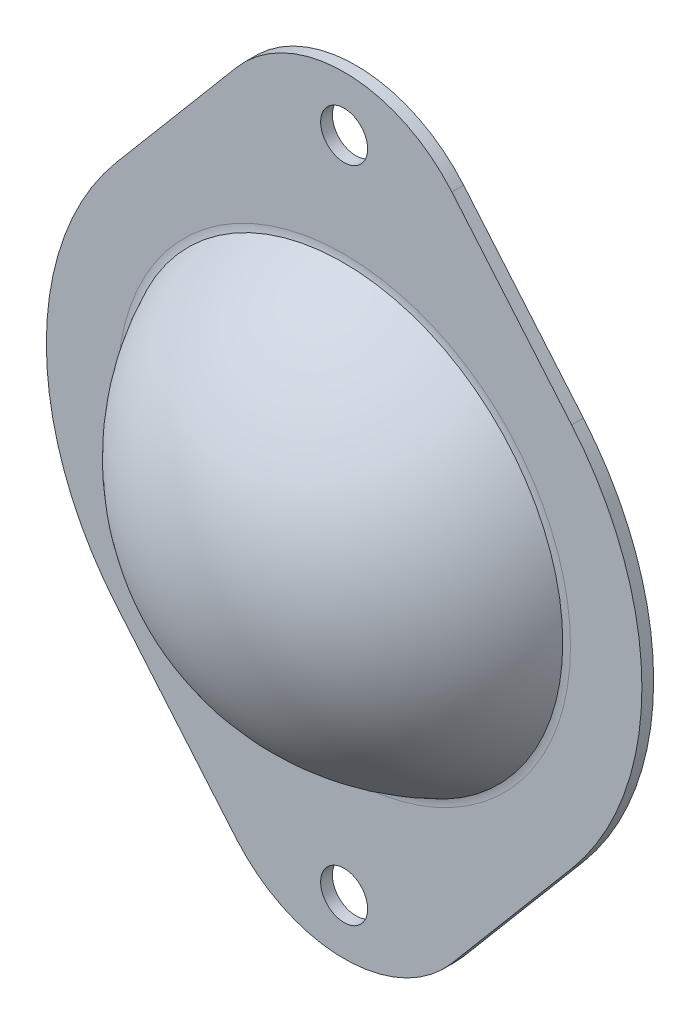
SolidWorks part; units mm, degrees
ref_plane "Plan1" through (0, 0, 0) normal (0, 0, 1) x (1, 0, 0)
ref_plane "Plan2" through (0, 0, 0) normal (0, 1, 0) x (1, 0, 0)
ref_plane "Plan3" through (0, 0, 0) normal (1, 0, 0) x (0, 0, -1)
sketch "Esquisse1" plane through (0, 0, 0) normal (0, 0, 1) x (1, 0, 0)
  line L0 (13.7528, 42.6129) -> (29.0338, 24.5161)
  line L1 (29.0338, -24.5161) -> (13.7528, -42.6129)
  line L2 (-29.0338, -24.5161) -> (-13.7528, -42.6129)
  line L3 (-13.7528, 42.6129) -> (-29.0338, 24.5161)
  arc A0 (29.0338, -24.5161) -> (29.0338, 24.5161) centre (0, 0) ccw
  arc A1 (13.7528, 42.6129) -> (-13.7528, 42.6129) centre (0, 31) ccw
  arc A2 (-13.7528, -42.6129) -> (13.7528, -42.6129) centre (0, -31) ccw
  arc A3 (-29.0338, 24.5161) -> (-29.0338, -24.5161) centre (0, 0) ccw
  circle A4 centre (0, 42) radius 3
  circle A5 centre (0, -42) radius 3
  dimension "D1" = 76
  dimension "D2" = 36
  dimension "D3" = 36
  dimension "D4" = 62
  dimension "D6" = 42
  dimension "D7" = 6
  dimension "D9" = 6
  dimension "D5" = 31
  dimension "D8" = 42
extrude "Base-Extrusion" add sketch "Esquisse1" along normal blind 1.5
sketch "Esquisse2" plane through (0, 0, 1.5) normal (0, 0, 1) x (1, 0, 0)
  circle A0 centre (0, 0) radius 28
  dimension "D1" = 56
extrude "Boss.-Extru.1" add sketch "Esquisse2" along normal blind 0.1
dome "Dôme1" faces to dome 1 distance 18 parameters "D1"=18
shell "Coque1" thickness 1.5
fillet "Congé1" radius 4
